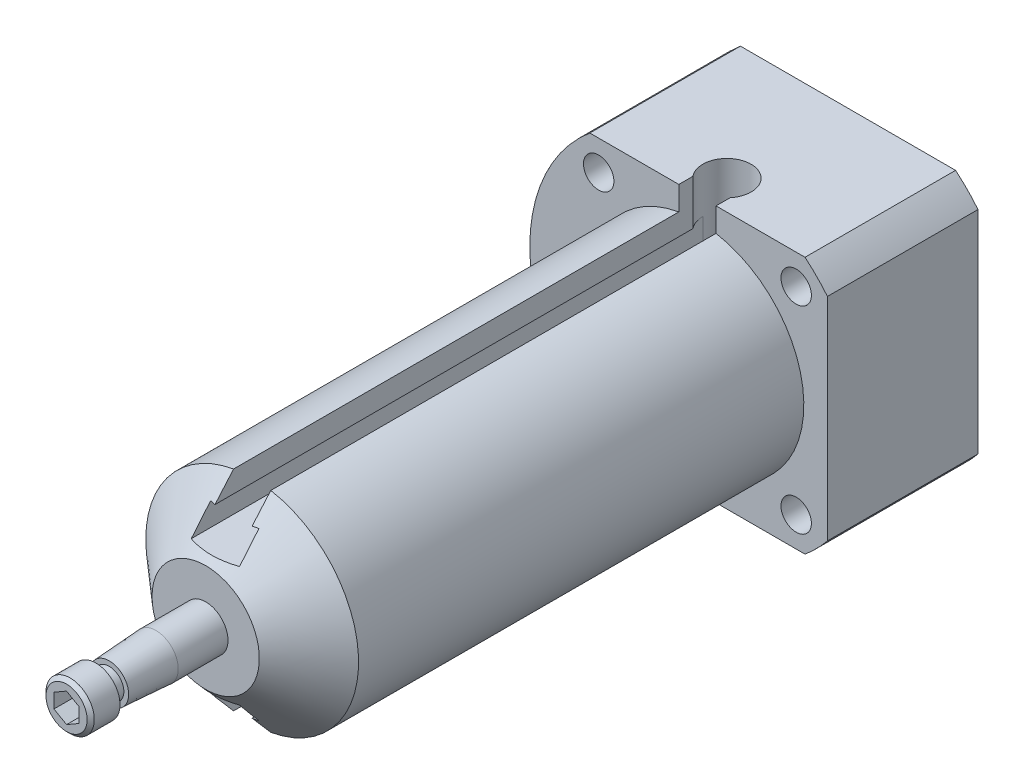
SolidWorks part; units mm, degrees
ref_plane "Front Plane" through (0, 0, 0) normal (0, 0, 1) x (1, 0, 0)
ref_plane "Top Plane" through (0, 0, 0) normal (0, 1, 0) x (1, 0, 0)
ref_plane "Right Plane" through (0, 0, 0) normal (1, 0, 0) x (0, 0, -1)
sketch "Sketch1" plane through (0, 0, 0) normal (0, 0, 1) x (1, 0, 0)
  line L0 (0, 0) -> (62.0084, 0) construction
  line L1 (-15.2811, 18.2626) -> (15.2811, 18.2626)
  line L2 (18.4658, 15.0349) -> (18.4658, -15.0349)
  line L3 (-15.2811, -18.2626) -> (15.2811, -18.2626)
  arc A0 (-15.2811, 18.2626) -> (-15.2811, -18.2626) centre (0, 0) ccw
  arc A1 (18.4658, 15.0349) -> (15.2811, 18.2626) centre (0, 0) ccw
  arc A2 (15.2811, -18.2626) -> (18.4658, -15.0349) centre (0, 0) ccw
  dimension "D1" = 47.625
  dimension "D2" = 36.5252
  dimension "D3" = 18.4658
extrude "Extrude1" add sketch "Sketch1" along normal blind 91.2368
sketch "Sketch2" plane through (0, 0, 0) normal (0, 1, 0) x (1, 0, 0)
  line L0 (0, 0) -> (0, -96.9332) construction
  line L1 (-23.8125, -21.3868) -> (-15.113, -21.3868)
  line L2 (-23.8125, 0) -> (-23.8125, -91.2368) construction
  line L3 (-15.113, -21.3868) -> (-15.113, -84.6328)
  line L4 (-15.113, -84.6328) -> (-7.62, -91.2368)
  line L7 (-7.62, -91.2368) -> (-23.8125, -91.2368)
  line L8 (-23.8125, -91.2368) -> (-23.8125, -21.3868)
  dimension "D1" = 69.85
  dimension "D2" = 30.226
  dimension "D3" = 15.24
  dimension "D4" = 6.604
revolve "Cut-Revolve1" cut sketch "Sketch2" angle 360 about L0
sketch "Sketch4" plane through (0, 0, 0) normal (0, 1, 0) x (1, 0, 0)
  line L0 (0, 0) -> (0, -99.9671) construction
  line L1 (-3.1686, -91.2368) -> (-3.1686, -98.298)
  line L2 (-7.62, -91.2368) -> (7.62, -91.2368) construction
  line L3 (-3.1686, -98.298) -> (-2.7622, -104.9426)
  line L4 (-2.7622, -104.9426) -> (0, -104.9426)
  line L7 (0, -104.9426) -> (0, -91.2368)
  line L8 (0, -91.2368) -> (-3.1686, -91.2368)
  line L10 (-15.2811, 0) -> (-23.8125, 0) construction
  dimension "D1" = 3.5
  dimension "D4" = 6.3373
  dimension "D5" = 5.5245
  dimension "D6" = 6.6446
  dimension "D7" = 98.298
revolve "Revolve1" add sketch "Sketch4" angle 360 about L0
hole_wizard "Hole1" positions "Sketch6" profile "Sketch5" legacy
sketch "Sketch6" plane through (0, 0, 104.9426) normal (0, 0, 1) x (1, 0, 0)
  circle A0 centre (0, 0) radius 2.7622 construction
  point P0 (0, 0)
sketch "Sketch5" plane through (0, 0, 104.9426) normal (1, 0, 0) x (0, -1, 0)
  line L0 (0, 0) -> (0, 20.0878)
  line L1 (0, 20.0878) -> (1.7272, 19.05)
  line L2 (1.7272, 19.05) -> (1.7272, 0)
  line L4 (1.7272, 0) -> (0, 0)
  line L6 (0, 20.0878) -> (-1.7272, 19.05) construction
  line L7 (0, -4.2442) -> (0, 117.3081) construction
  dimension "Diameter" = 3.4544
  dimension "Depth" = 19.05
  dimension "Drill Angle" = 118
hole_wizard "Hole2" positions "Sketch10" profile "Sketch9" legacy
sketch "Sketch10" plane through (0, 0, 21.3868) normal (0, 0, 1) x (1, 0, 0)
  line L1 (0, 0) -> (19.5659, 0) construction
  line L2 (0, 0) -> (14.0272, 14.0272) construction
  circle A0 centre (0, 0) radius 19.8374 construction
  point P0 (14.0272, 14.0272)
  dimension "D2" = 39.6748
  dimension "D1" = 45
sketch "Sketch9" plane through (14.0272, 14.0272, 21.3868) normal (1, 0, 0) x (0, -1, 0)
  line L0 (0, 0) -> (0, 21.3878)
  line L1 (0, 21.3878) -> (2.159, 21.3878)
  line L2 (2.159, 21.3878) -> (2.159, 0)
  line L3 (2.159, 0) -> (0, 0)
  line L4 (0, 110) -> (0, -10) construction
  dimension "Diameter" = 4.318
  dimension "Depth" = 21.3878
pattern_circular "CirPattern1" count 4 over 360 about axis through (0, 0, 0) along (0, 0, 1) of "Hole2"
ref_plane "Plane1" through (0, 0, 14.2748) normal (0, 0, -1) x (-1, 0, 0)
sketch "Sketch11" plane through (0, 0, 14.2748) normal (0, 0, -1) x (-1, 0, 0)
  line L0 (0, 0) -> (25.0527, 10.6342) construction
  line L1 (0, 0) -> (27.0444, 0) construction
  line L2 (56.5322, 28.5218) -> (9.7705, 8.6727)
  line L3 (9.7705, 8.6727) -> (11.3982, 4.8382)
  line L4 (11.3982, 4.8382) -> (58.1598, 24.6874)
  line L5 (58.1598, 24.6874) -> (56.5322, 28.5218)
  dimension "D1" = 23
  dimension "D2" = 12.3825
  dimension "D3" = 8.3312
  dimension "D4" = 50.8
revolve "Cut-Revolve2" cut sketch "Sketch11" angle 360 about L0
mirror "Mirror1" about plane through (0, 0, 0) normal (0, 1, 0) of "Cut-Revolve2"
sketch "Sketch12" plane through (0, 0, 91.2368) normal (0, 0, 1) x (1, 0, 0)
  line L0 (0, 0) -> (0, 26.7352) construction
  line L1 (-2.6416, 50.8) -> (-2.6416, 11.8237)
  line L2 (-2.6416, 11.8237) -> (-3.429, 11.8237)
  line L3 (-3.429, 11.8237) -> (-3.429, 8.5217)
  line L4 (-3.429, 8.5217) -> (3.429, 8.5217)
  line L5 (3.429, 11.8237) -> (3.429, 8.5217)
  line L6 (2.6416, 11.8237) -> (3.429, 11.8237)
  line L7 (2.6416, 50.8) -> (2.6416, 11.8237)
  line L8 (-2.6416, 50.8) -> (2.6416, 50.8)
  dimension "D1" = 5.2832
  dimension "D2" = 6.858
  dimension "D3" = 3.302
  dimension "D4" = 8.5217
  dimension "D5" = 50.8
extrude "Cut-Extrude1" cut sketch "Sketch12" against normal blind 74.041
sketch "Sketch13" plane through (0, 0, 91.2368) normal (0, 0, 1) x (1, 0, 0)
  line L0 (0, 0) -> (32.0428, 0) construction
  line L1 (0, 0) -> (0, -27.5102) construction
  line L2 (-3.429, -8.5217) -> (3.429, -8.5217)
  line L3 (3.429, -8.5217) -> (3.429, -11.8237)
  line L4 (3.429, -11.8237) -> (2.6416, -11.8237)
  line L5 (2.6416, -11.8237) -> (2.6416, -50.8)
  line L6 (2.6416, -50.8) -> (-2.6416, -50.8)
  line L7 (-3.429, 8.5217) -> (3.429, 8.5217) construction
  line L8 (3.429, 11.8237) -> (3.429, 8.5217) construction
  line L9 (2.6416, 50.8) -> (2.6416, 11.8237) construction
  line L10 (-2.6416, -11.8237) -> (-2.6416, -50.8)
  line L11 (-3.429, -11.8237) -> (-2.6416, -11.8237)
  line L12 (-3.429, -8.5217) -> (-3.429, -11.8237)
extrude "Cut-Extrude2" cut sketch "Sketch13" against normal blind 53.975
sketch "Sketch14" plane through (0, 18.2626, 0) normal (0, 1, 0) x (1, 0, 0)
  line L0 (-2.6416, -17.1958) -> (2.6416, -17.1958) construction
  circle A0 centre (0, -17.1958) radius 3.429
  dimension "D1" = 3.429
extrude "Cut-Extrude3" cut sketch "Sketch14" against normal up to surface (9.7409 mm away)
sketch "Sketch15" plane through (0, -18.2626, 0) normal (0, -1, 0) x (1, 0, 0)
  line L0 (3.429, 37.2618) -> (-3.429, 37.2618) construction
  circle A0 centre (0, 37.2618) radius 3.429
  dimension "D1" = 3.429
extrude "Cut-Extrude4" cut sketch "Sketch15" against normal up to surface (9.7409 mm away)
sketch "Sketch16" plane through (0, 0, 0) normal (0, 1, 0) x (1, 0, 0)
  line L0 (0, 0) -> (0, -122.9241) construction
  line L1 (-2.0828, -104.9426) -> (-2.0828, -106.8324)
  line L2 (-2.7622, -104.9426) -> (2.7622, -104.9426) construction
  line L3 (-2.0828, -106.8324) -> (-3.429, -106.8324)
  line L4 (-3.429, -106.8324) -> (-3.429, -110.49)
  line L5 (-3.429, -110.49) -> (-2.921, -110.998)
  line L6 (-2.921, -110.998) -> (0, -110.998)
  line L7 (0, -110.998) -> (0, -104.9426)
  line L8 (0, -104.9426) -> (-2.0828, -104.9426)
  line L9 (-3.1686, -98.298) -> (3.1686, -98.298) construction
  dimension "D1" = 4.1656
  dimension "D2" = 8.5344
  dimension "D3" = 6.858
  dimension "D4" = 4.1656
  dimension "D5" = 45
  dimension "D6" = 5.842
revolve "Revolve2" add sketch "Sketch16" angle 360 about L0
sketch "Sketch17" plane through (0, 0, 110.998) normal (0, 0, 1) x (1, 0, 0)
  line L1 (1.7859, -1.0311) -> (1.7859, 1.0311)
  line L2 (1.7859, 1.0311) -> (0, 2.0622)
  line L3 (0, 2.0622) -> (-1.7859, 1.0311)
  line L4 (-1.7859, 1.0311) -> (-1.7859, -1.0311)
  line L5 (-1.7859, -1.0311) -> (0, -2.0622)
  line L6 (0, -2.0622) -> (1.7859, -1.0311)
  circle A0 centre (0, 0) radius 1.7859 construction
  dimension "D1" = 3.5719
extrude "Cut-Extrude5" cut sketch "Sketch17" against normal blind 3.175
